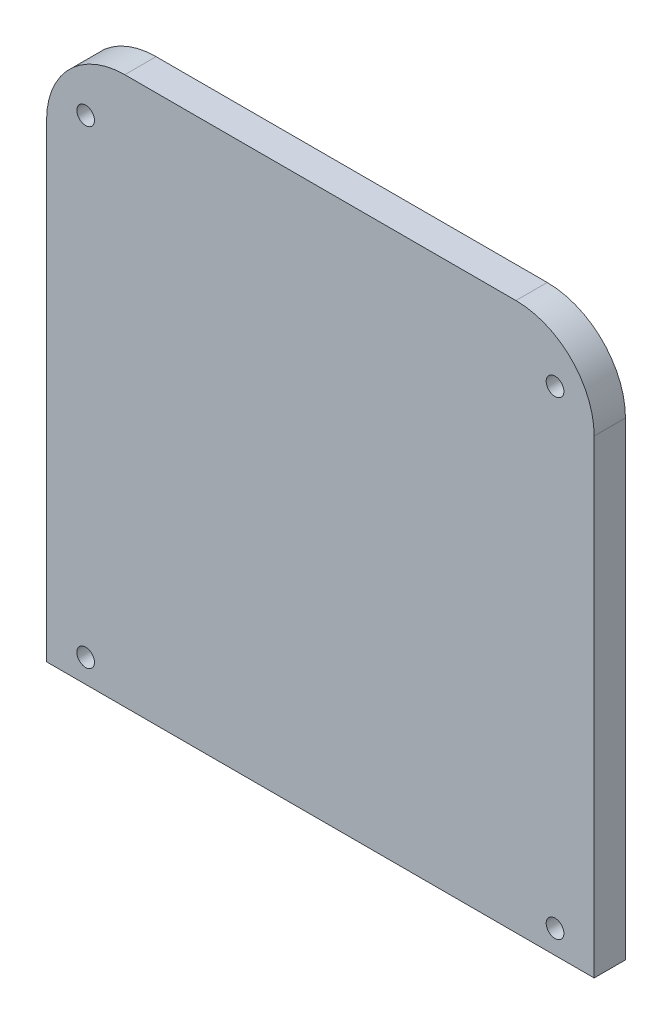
SolidWorks part; units mm, degrees
ref_plane "Front Plane" through (0, 0, 0) normal (0, 0, 1) x (1, 0, 0)
ref_plane "Top Plane" through (0, 0, 0) normal (0, 1, 0) x (1, 0, 0)
ref_plane "Right Plane" through (0, 0, 0) normal (1, 0, 0) x (0, 0, -1)
sketch "Sketch1" plane through (0, 0, 0) normal (0, 0, 1) x (1, 0, 0)
  line L1 (35, -35) -> (-35, -35)
  line L2 (35, -35) -> (35, 35)
  line L3 (35, 35) -> (-35, 35)
  line L4 (-35, -35) -> (-35, 35)
  line L5 (35, -35) -> (-35, 35) construction
  line L6 (35, 35) -> (-35, -35) construction
  point P0 (0, 0)
  dimension "D1" = 70
  dimension "D2" = 70
extrude "Boss-Extrude1" add sketch "Sketch1" along normal blind 4
hole_wizard "#4-40 Tapped Hole1" positions "Sketch3" profile "Sketch2" tap size "#4-40" standard "ANSI Inch"
sketch "Sketch3" plane through (0, 0, 0) normal (0, 0, -1) x (-1, 0, 0)
  line L1 (30, -32) -> (-30, -32)
  line L2 (30, -32) -> (30, 28)
  line L3 (30, 28) -> (-30, 28)
  line L4 (-30, -32) -> (-30, 28)
  line L6 (30, 28) -> (-30, -32) construction
  line L7 (-30, 28) -> (30, -32) construction
  line L9 (0, 0) -> (0, -2) construction
  point P0 (-30, 28)
  point P7 (30, -32)
  point P8 (30, 28)
  point P9 (-30, -32)
  point P120 (0, 0)
  dimension "D1" = 60
  dimension "D2" = 60
  dimension "D3" = 2
sketch "Sketch2" plane through (30, 28, 0) normal (1, 0, 0) x (0, 1, 0)
  line L0 (0, 0) -> (0, 4)
  line L1 (0, 4) -> (1.1303, 4)
  line L2 (1.1303, 4) -> (1.1303, 0)
  line L5 (1.1303, 0) -> (0, 0)
  line L11 (0, -6.35) -> (0, 107.95) construction
  dimension "Thru Tap Drill Dia." = 2.2606
  dimension "Thru Tap Drill Depth" = 4
fillet "Fillet6" radius 10 2 edges at (35, 35, 2) (-35, 35, 2)
